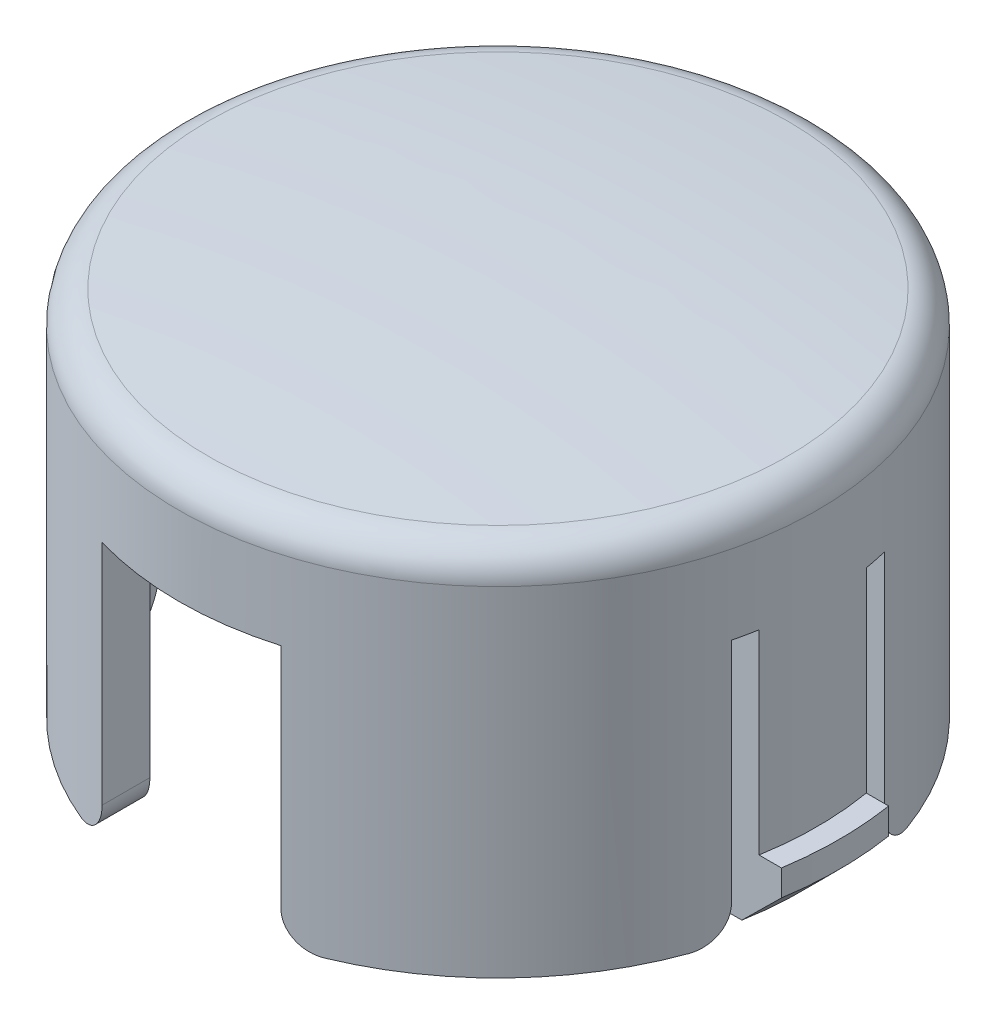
SolidWorks part; units mm, degrees
ref_plane "Front Plane" through (0, 0, 0) normal (0, 0, 1) x (1, 0, 0)
ref_plane "Top Plane" through (0, 0, 0) normal (0, 1, 0) x (1, 0, 0)
ref_plane "Right Plane" through (0, 0, 0) normal (1, 0, 0) x (0, 0, -1)
imported_body "Imported2"
imported_body "Imported3"
sketch "Sketch1" plane through (0, -9.0477, 0) normal (0, -1, 0) x (1, 0, 0)
  circle A0 centre (0, 0) radius 10.6934
extrude "Cut-Extrude1" cut sketch "Sketch1" against normal blind 13.0086
sketch "Sketch2" plane through (0, -9.0477, 0) normal (0, -1, 0) x (1, 0, 0)
  line L0 (12.2941, -2.0955) -> (10.4861, -2.0955)
  line L1 (-10.4861, -2.0955) -> (-12.2941, -2.0955)
  arc A0 (-12.2941, -2.0955) -> (12.2941, -2.0955) centre (0, 0) ccw
  arc A1 (10.4861, -2.0955) -> (-10.4861, -2.0955) centre (0, 0) cw
extrude "Cut-Extrude2" cut sketch "Sketch2" against normal blind 1.524
sketch "Sketch3" plane through (0, -9.0477, 0) normal (0, -1, 0) x (1, 0, 0)
  line L0 (-12.2941, 2.0955) -> (-10.4861, 2.0955)
  line L1 (10.4861, 2.0955) -> (12.2941, 2.0955)
  arc A0 (12.2941, 2.0955) -> (-12.2941, 2.0955) centre (0, 0) ccw
  arc A1 (-10.4861, 2.0955) -> (10.4861, 2.0955) centre (0, 0) cw
extrude "Cut-Extrude3" cut sketch "Sketch3" against normal blind 1.524
sketch "Sketch4" plane through (0, -7.5237, 0) normal (0, -1, 0) x (1, 0, 0)
  line L0 (12.2941, -2.0955) -> (10.4861, -2.0955)
  line L1 (-10.4861, -2.0955) -> (-12.2941, -2.0955)
  arc A0 (-12.2941, -2.0955) -> (12.2941, -2.0955) centre (0, 0) ccw
  arc A1 (10.4861, -2.0955) -> (-10.4861, -2.0955) centre (0, 0) cw
extrude "Cut-Extrude4" cut sketch "Sketch4" against normal blind 8.636
sketch "Sketch5" plane through (0, -7.5237, 0) normal (0, -1, 0) x (1, 0, 0)
  line L0 (-12.2941, 2.0955) -> (-10.4861, 2.0955)
  line L1 (10.4861, 2.0955) -> (12.2941, 2.0955)
  arc A0 (12.2941, 2.0955) -> (-12.2941, 2.0955) centre (0, 0) ccw
  arc A1 (-10.4861, 2.0955) -> (10.4861, 2.0955) centre (0, 0) cw
extrude "Cut-Extrude5" cut sketch "Sketch5" against normal blind 8.636
sketch "Sketch6" plane through (0, 5.3358, 0) normal (0, 1, 0) x (-1, 0, 0)
  line L0 (-12.2941, 2.0955) -> (-13.1693, 2.0955)
  line L1 (-13.1693, -2.0955) -> (-12.2941, -2.0955)
  line L2 (13.1693, 2.0955) -> (12.2941, 2.0955)
  line L3 (12.2941, -2.0955) -> (13.1693, -2.0955)
  arc A0 (-12.2941, -2.0955) -> (-12.2941, 2.0955) centre (0, 0) cw
  arc A1 (-13.1693, 2.0955) -> (-13.1693, -2.0955) centre (0, 0) ccw
  arc A2 (12.2941, 2.0955) -> (12.2941, -2.0955) centre (0, 0) cw
  arc A3 (13.1693, -2.0955) -> (13.1693, 2.0955) centre (0, 0) ccw
extrude "Cut-Extrude6" cut sketch "Sketch6" against normal blind 4.2235
sketch "Sketch7" plane through (0, 1.1123, 0) normal (0, 1, 0) x (-1, 0, 0)
  line L0 (13.1693, 2.0955) -> (12.2941, 2.0955)
  line L1 (12.2941, -2.0955) -> (13.1693, -2.0955)
  arc A0 (12.2941, 2.0955) -> (12.2941, -2.0955) centre (0, 0) cw
  arc A1 (13.1693, -2.0955) -> (13.1693, 2.0955) centre (0, 0) ccw
extrude "Cut-Extrude7" cut sketch "Sketch7" against normal blind 7.62
sketch "Sketch8" plane through (0, 1.1123, 0) normal (0, 1, 0) x (-1, 0, 0)
  line L0 (-12.2941, 2.0955) -> (-13.1693, 2.0955)
  line L1 (-13.1693, -2.0955) -> (-12.2941, -2.0955)
  arc A0 (-12.2941, -2.0955) -> (-12.2941, 2.0955) centre (0, 0) cw
  arc A1 (-13.1693, 2.0955) -> (-13.1693, -2.0955) centre (0, 0) ccw
extrude "Cut-Extrude8" cut sketch "Sketch8" against normal blind 7.62
sketch "Sketch9" plane through (0, 1.1123, 0) normal (0, -1, 0) x (1, 0, 0)
  line L0 (10.2685, -2.9845) -> (12.109, -2.9845)
  line L1 (3.4925, -11.9724) -> (3.4925, -10.107)
  arc A0 (3.4925, -10.107) -> (10.2685, -2.9845) centre (0, 0) ccw
  arc A1 (12.109, -2.9845) -> (3.4925, -11.9724) centre (0, 0) cw
extrude "Boss-Extrude1" add sketch "Sketch9" along normal blind 7.62
sketch "Sketch10" plane through (0, 1.1123, 0) normal (0, -1, 0) x (1, 0, 0)
  line L0 (12.109, 2.9845) -> (10.2685, 2.9845)
  line L1 (3.4925, 10.107) -> (3.4925, 11.9724)
  arc A0 (3.4925, 11.9724) -> (12.109, 2.9845) centre (0, 0) cw
  arc A1 (10.2685, 2.9845) -> (3.4925, 10.107) centre (0, 0) ccw
extrude "Boss-Extrude2" add sketch "Sketch10" along normal blind 7.62
sketch "Sketch11" plane through (0, 1.1123, 0) normal (0, -1, 0) x (1, 0, 0)
  line L0 (-3.4925, 11.9724) -> (-3.4925, 10.107)
  line L1 (-10.2685, 2.9845) -> (-12.109, 2.9845)
  arc A0 (-3.4925, 10.107) -> (-10.2685, 2.9845) centre (0, 0) ccw
  arc A1 (-12.109, 2.9845) -> (-3.4925, 11.9724) centre (0, 0) cw
extrude "Boss-Extrude3" add sketch "Sketch11" along normal blind 7.62
sketch "Sketch12" plane through (0, -6.5077, 0) normal (0, -1, 0) x (1, 0, 0)
  line L0 (12.109, 2.9845) -> (10.2685, 2.9845)
  line L1 (3.4925, 10.107) -> (3.4925, 11.9724)
  line L2 (-3.4925, 11.9724) -> (-3.4925, 10.107)
  line L3 (-10.2685, 2.9845) -> (-12.109, 2.9845)
  arc A0 (3.4925, 11.9724) -> (12.109, 2.9845) centre (0, 0) cw
  arc A1 (10.2685, 2.9845) -> (3.4925, 10.107) centre (0, 0) ccw
  arc A2 (-3.4925, 10.107) -> (-10.2685, 2.9845) centre (0, 0) ccw
  arc A3 (-12.109, 2.9845) -> (-3.4925, 11.9724) centre (0, 0) cw
extrude "Boss-Extrude4" add sketch "Sketch12" along normal blind 2.54
sketch "Sketch13" plane through (0, -6.5077, 0) normal (0, -1, 0) x (1, 0, 0)
  line L0 (10.2685, -2.9845) -> (12.109, -2.9845)
  line L1 (3.4925, -11.9724) -> (3.4925, -10.107)
  arc A0 (3.4925, -10.107) -> (10.2685, -2.9845) centre (0, 0) ccw
  arc A1 (12.109, -2.9845) -> (3.4925, -11.9724) centre (0, 0) cw
extrude "Boss-Extrude5" add sketch "Sketch13" along normal blind 2.54
sketch "Sketch14" plane through (0, 1.1123, 0) normal (0, -1, 0) x (1, 0, 0)
  line L0 (-3.4925, -10.107) -> (-3.4925, -11.9724)
  line L1 (-12.109, -2.9845) -> (-10.2685, -2.9845)
  arc A0 (-3.4925, -11.9724) -> (-12.109, -2.9845) centre (0, 0) cw
  arc A1 (-10.2685, -2.9845) -> (-3.4925, -10.107) centre (0, 0) ccw
extrude "Boss-Extrude6" add sketch "Sketch14" along normal blind 7.62
sketch "Sketch15" plane through (0, -6.5077, 0) normal (0, -1, 0) x (1, 0, 0)
  line L0 (-3.4925, -10.107) -> (-3.4925, -11.9724)
  line L1 (-12.109, -2.9845) -> (-10.2685, -2.9845)
  arc A0 (-3.4925, -11.9724) -> (-12.109, -2.9845) centre (0, 0) cw
  arc A1 (-10.2685, -2.9845) -> (-3.4925, -10.107) centre (0, 0) ccw
extrude "Boss-Extrude7" add sketch "Sketch15" along normal blind 2.54
sketch "Sketch16" plane through (0, 3.9609, 0) normal (0, -1, 0) x (1, 0, 0)
  line L0 (1.651, 3.8481) -> (1.651, -3.8481)
  line L1 (1.651, -3.8481) -> (-1.651, -3.8481)
  line L2 (-1.651, -3.8481) -> (-1.651, 3.8481)
  line L3 (-1.651, 3.8481) -> (1.651, 3.8481)
extrude "Boss-Extrude8" add sketch "Sketch16" along normal blind 13.0594
sketch "Sketch17" plane through (0, -9.0985, 0) normal (0, -1, 0) x (1, 0, 0)
  line L0 (-0.889, -3.0861) -> (0.889, -3.0861)
  line L1 (0.889, -3.0861) -> (0.889, 3.0861)
  line L2 (0.889, 3.0861) -> (-0.889, 3.0861)
  line L3 (-0.889, 3.0861) -> (-0.889, -3.0861)
extrude "Cut-Extrude9" cut sketch "Sketch17" against normal blind 13.0594
ref_plane "Plane1" through (0, 0, 0) normal (-0.7071, 0, 0.7071) x (0, -1, 0)
sketch "Sketch18" plane through (0, 0, 0) normal (-0.7071, 0, 0.7071) x (0, -1, 0)
  line L0 (3.6591, 2.3349) -> (3.6591, 10.6934)
rib "Rib1" sketch "Sketch18" sketch "Sketch18" thickness 1.016 extrusion direction parallel to sketch draft on no parameters "D1"=1.016
ref_plane "Plane2" through (0, 0, 0) normal (0.7071, 0, 0.7071) x (0, 1, 0)
sketch "Sketch19" plane through (0, 0, 0) normal (0.7071, 0, 0.7071) x (0, 1, 0)
  line L0 (-3.6591, -2.3349) -> (-3.6591, -10.6934)
rib "Rib2" sketch "Sketch19" sketch "Sketch19" thickness 1.016 extrusion direction parallel to sketch draft on no parameters "D1"=1.016
ref_plane "Plane3" through (0, 0, 0) normal (-0.7071, 0, -0.7071) x (0, -1, 0)
sketch "Sketch20" plane through (0, 0, 0) normal (-0.7071, 0, -0.7071) x (0, -1, 0)
  line L0 (3.6591, 2.3349) -> (3.6591, 10.6934)
rib "Rib3" sketch "Sketch20" sketch "Sketch20" thickness 1.016 extrusion direction parallel to sketch draft on no parameters "D1"=1.016
ref_plane "Plane4" through (0, 0, 0) normal (0.7071, 0, -0.7071) x (0, 1, 0)
sketch "Sketch21" plane through (0, 0, 0) normal (0.7071, 0, -0.7071) x (0, 1, 0)
  line L0 (-3.6591, -2.3349) -> (-3.6591, -10.6934)
rib "Rib4" sketch "Sketch21" sketch "Sketch21" thickness 1.016 extrusion direction parallel to sketch draft on no parameters "D1"=1.016
fillet "Fillet1" radius 1.27 9 edges at (0, 5.3358, -12.4714) (3.4925, -9.0477, 11.0397) (11.1888, -9.0477, 2.9845) (-11.1888, -9.0477, 2.9845) (-3.4925, -9.0477, 11.0397) (3.4925, -9.0477, -11.0397) (11.1888, -9.0477, -2.9845) (-11.1888, -9.0477, -2.9845) (-3.4925, -9.0477, -11.0397)
